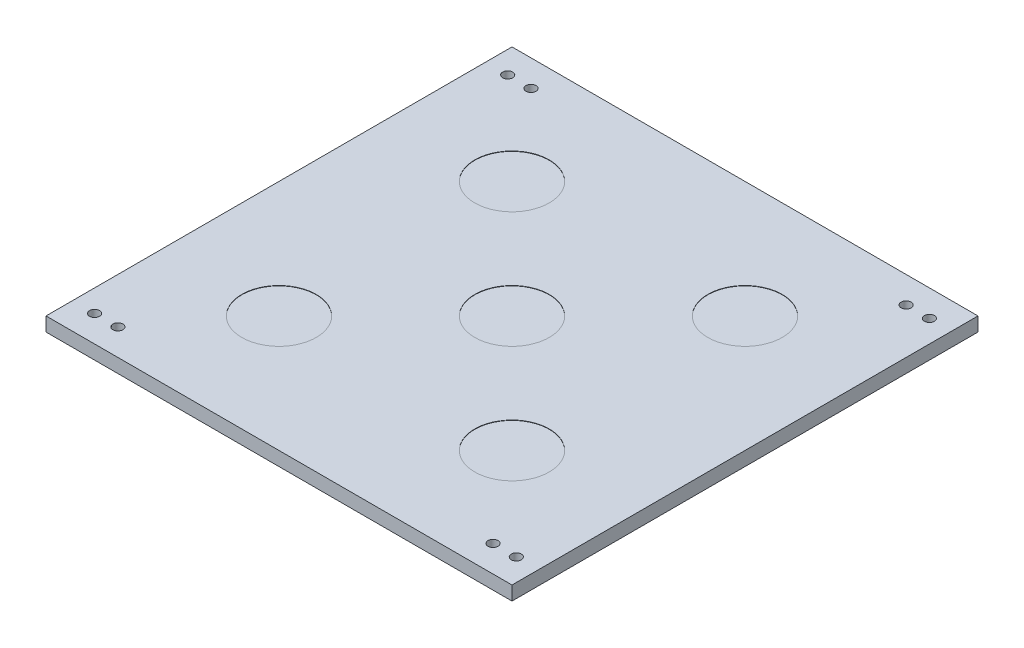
SolidWorks part; units mm, degrees
ref_plane "Front Plane" through (0, 0, 0) normal (0, 0, 1) x (1, 0, 0)
ref_plane "Top Plane" through (0, 0, 0) normal (0, 1, 0) x (1, 0, 0)
ref_plane "Right Plane" through (0, 0, 0) normal (1, 0, 0) x (0, 0, -1)
sketch "Sketch1" plane through (0, 0, 0) normal (0, 1, 0) x (1, 0, 0)
  line L0 (0, -55) -> (0, 55) construction
  line L1 (100, -100) -> (-100, -100)
  line L2 (100, -100) -> (100, 100)
  line L3 (100, 100) -> (-100, 100)
  line L4 (-100, -100) -> (-100, 100)
  line L5 (100, -100) -> (-100, 100) construction
  line L6 (100, 100) -> (-100, -100) construction
  line L7 (-150, 95) -> (-75, 95) construction
  line L8 (-150, 95) -> (-150, 82.3) construction
  line L9 (-150, 82.3) -> (-75, 82.3) construction
  line L10 (-75, 95) -> (-75, 82.3) construction
  line L11 (-55, 0) -> (55, 0) construction
  line L13 (-75, 82.3) -> (-100, 82.3) construction
  line L14 (-75, 82.3) -> (-75, 95) construction
  line L15 (-75, 95) -> (-100, 95) construction
  line L16 (-100, 82.3) -> (-100, 95) construction
  line L17 (-75, 82.3) -> (-100, 95) construction
  line L18 (-75, 95) -> (-100, 82.3) construction
  line L19 (-75, 77.3) -> (-100, 77.3) construction
  line L20 (-75, 77.3) -> (-75, 100) construction
  line L21 (-75, 100) -> (-100, 100) construction
  line L22 (-100, 77.3) -> (-100, 100) construction
  line L23 (-75, 77.3) -> (-100, 100) construction
  line L24 (-75, 100) -> (-100, 77.3) construction
  circle A0 centre (-80.5, 88.65) radius 2.15
  circle A1 centre (-90.5, 88.65) radius 2.15
  circle A2 centre (80.5, 88.65) radius 2.15
  circle A3 centre (90.5, 88.65) radius 2.15
  circle A4 centre (90.5, -88.65) radius 2.15
  circle A5 centre (80.5, -88.65) radius 2.15
  circle A6 centre (-80.5, -88.65) radius 2.15
  circle A7 centre (-90.5, -88.65) radius 2.15
  point P0 (0, 0)
  point P14 (-112.5, 95)
  point P15 (-150, 88.65)
  point P16 (-87.5, 88.65)
  point P37 (-87.5, 88.65)
  dimension "D3" = 4.3
  dimension "D1" = 200
  dimension "D2" = 200
  dimension "D4" = 75
  dimension "D5" = 12.7
  dimension "D6" = 5
  dimension "D7" = 22
  dimension "D8" = 32
  dimension "D9" = 9.5
extrude "Boss-Extrude1" add sketch "Sketch1" along normal blind 6
sketch "Sketch2" plane through (0, 6, 0) normal (0, 1, 0) x (1, 0, 0)
  circle A0 centre (0, 0) radius 16
  circle A1 centre (-50, 50) radius 16
  circle A5 centre (50, 50) radius 16
  circle A6 centre (50, -50) radius 16
  circle A7 centre (-50, -50) radius 16
  point P14 (0, 0)
  dimension "D1" = 32
  dimension "D2" = 50
  dimension "D3" = 50
  dimension "D4" = 4
extrude "Cut-Extrude1" cut sketch "Sketch2" against normal blind 0.15
